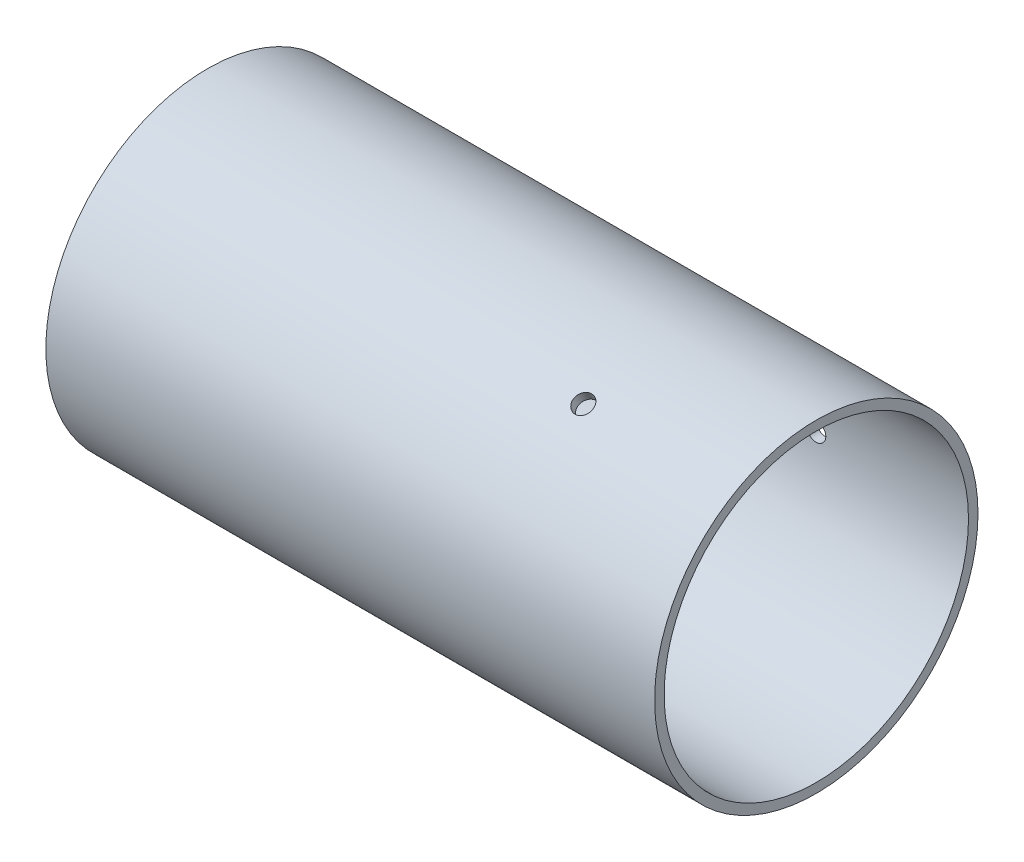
SolidWorks part; units mm, degrees
ref_plane "Front Plane" through (0, 0, 0) normal (0, 0, 1) x (1, 0, 0)
ref_plane "Top Plane" through (0, 0, 0) normal (0, 1, 0) x (1, 0, 0)
ref_plane "Right Plane" through (0, 0, 0) normal (1, 0, 0) x (0, 0, -1)
sketch "Sketch1" plane through (0, 0, 0) normal (1, 0, 0) x (0, 0, -1)
  circle A0 centre (0, 0) radius 26.9875
  circle A1 centre (0, 0) radius 25.4
  dimension "D1" = 53.975
  dimension "D2" = 50.8
extrude "Extrude1" add sketch "Sketch1" along normal blind 101.6
sketch "Sketch2" plane through (0, 0, 0) normal (0, 0, 1) x (1, 0, 0)
  line L0 (0, 0) -> (101.6, 0) construction
  line L1 (101.6, -26.9875) -> (101.6, 26.9875) construction
ref_plane "Plane1" through (0, 0, 0) normal (0, -0.866, -0.5) x (1, 0, 0)
ref_plane "Plane2" through (0, 0, 0) normal (0, 0.866, -0.5) x (-1, 0, 0)
sketch "Sketch3" plane through (0, 0, 0) normal (0, 0, 1) x (1, 0, 0)
  line L0 (0, 0) -> (101.6, 0) construction
  line L1 (101.6, -26.9875) -> (101.6, 26.9875) construction
  circle A0 centre (76.2, 0) radius 1.5875
  dimension "D2" = 3.175
  dimension "D1" = 25.4
extrude "Cut-Extrude1" cut sketch "Sketch3" against normal through all
sketch "Sketch4" plane through (0, 0, 0) normal (0, -0.866, -0.5) x (1, 0, 0)
  line L0 (0, 0) -> (101.6, 0) construction
  line L1 (101.6, -26.9875) -> (101.6, 26.9875) construction
  circle A0 centre (76.2, 0) radius 1.5875
  dimension "D2" = 3.175
  dimension "D1" = 25.4
extrude "Cut-Extrude2" cut sketch "Sketch4" against normal through all
sketch "Sketch5" plane through (0, 0, 0) normal (0, 0.866, -0.5) x (-1, 0, 0)
  line L0 (0, 0) -> (-101.6, 0) construction
  line L1 (-101.6, 26.9875) -> (-101.6, -26.9875) construction
  circle A0 centre (-76.2, 0) radius 1.5875
  dimension "D2" = 3.175
  dimension "D1" = 25.4
extrude "Cut-Extrude3" cut sketch "Sketch5" against normal through all
